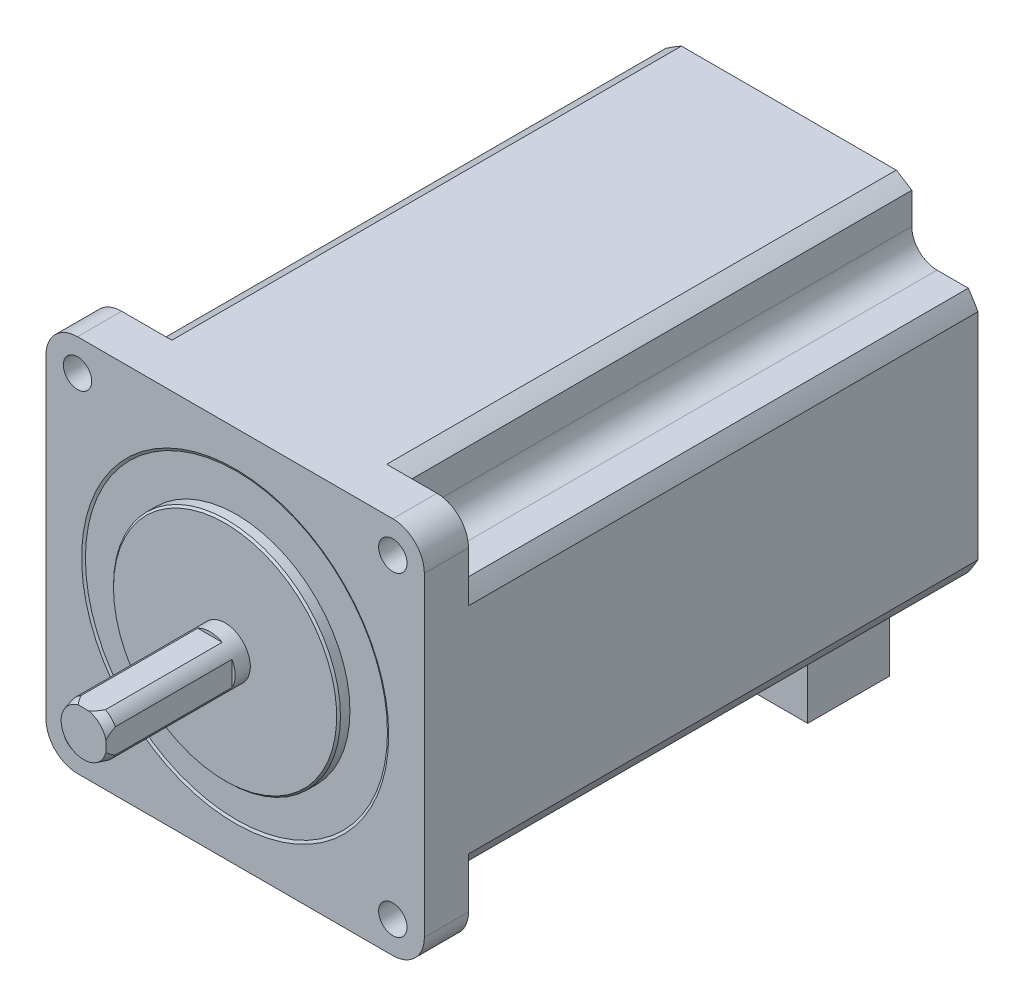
SolidWorks part; units mm, degrees
ref_plane "正面" through (0, 0, 0) normal (0, 0, 1) x (1, 0, 0)
ref_plane "平面" through (0, 0, 0) normal (0, 1, 0) x (1, 0, 0)
ref_plane "右側面" through (0, 0, 0) normal (1, 0, 0) x (0, 0, -1)
sketch "ｽｹｯﾁ1" plane through (0, 0, 0) normal (0, 0, 1) x (1, 0, 0)
  circle A0 centre (0, 0) radius 4
  dimension "D1" = 8
extrude "押し出し1" add sketch "ｽｹｯﾁ1" along normal blind 22.4
sketch "ｽｹｯﾁ2" plane through (0, 0, 0) normal (0, 0, -1) x (-1, 0, 0)
  circle A0 centre (0, 0) radius 18
  dimension "D1" = 36
extrude "押し出し2" add sketch "ｽｹｯﾁ2" along normal blind 1.6
sketch "ｽｹｯﾁ3" plane through (0, 0, -1.6) normal (0, 0, -1) x (-1, 0, 0)
  line L1 (-30, 30) -> (30, 30)
  line L2 (-30, 30) -> (-30, -30)
  line L3 (-30, -30) -> (30, -30)
  line L4 (30, 30) -> (30, -30)
  line L5 (-30, 30) -> (30, -30) construction
  line L6 (-30, -30) -> (30, 30) construction
  line L7 (25, 25) -> (-25, 25) construction
  line L8 (25, 25) -> (25, -25) construction
  line L9 (25, -25) -> (-25, -25) construction
  line L10 (-25, 25) -> (-25, -25) construction
  line L11 (25, 25) -> (-25, -25) construction
  line L12 (25, -25) -> (-25, 25) construction
  circle A0 centre (25, 25) radius 2.25
  circle A1 centre (-25, 25) radius 2.25
  circle A2 centre (25, -25) radius 2.25
  circle A3 centre (-25, -25) radius 2.25
  point P0 (0, 0)
  point P6 (0, 0)
  dimension "D3" = 50
  dimension "D4" = 50
  dimension "D6" = 4.5
  dimension "D1" = 60
  dimension "D2" = 60
extrude "押し出し3" add sketch "ｽｹｯﾁ3" along normal blind 7
fillet "Fillet1" radius 5 4 edges at (30, -30, -5.1) (-30, -30, -5.1) (-30, 30, -5.1) (30, 30, -5.1)
sketch "ｽｹｯﾁ4" plane through (0, 0, -8.6) normal (0, 0, -1) x (-1, 0, 0)
  line L0 (19.5, 19.5) -> (30, 19.5)
  line L1 (-19.5, 30) -> (19.5, 30)
  line L2 (-19.5, 30) -> (-19.5, 19.5)
  line L3 (-19.5, -30) -> (19.5, -30)
  line L4 (19.5, 30) -> (19.5, 19.5)
  line L5 (-19.5, 30) -> (19.5, -30) construction
  line L6 (-19.5, -30) -> (19.5, 30) construction
  line L7 (-30, 19.5) -> (-19.5, 19.5)
  line L8 (-30, 19.5) -> (-30, -19.5)
  line L9 (-30, -19.5) -> (-19.5, -19.5)
  line L10 (30, 19.5) -> (30, -19.5)
  line L11 (-30, 19.5) -> (30, -19.5) construction
  line L12 (-30, -19.5) -> (30, 19.5) construction
  line L13 (-19.5, -19.5) -> (-19.5, -30)
  line L14 (19.5, -19.5) -> (30, -19.5)
  line L15 (19.5, -19.5) -> (19.5, -30)
  circle A0 centre (0, 0) radius 34.5
  point P0 (0, 0)
  point P6 (0, 0)
  dimension "D5" = 69
  dimension "D1" = 39
  dimension "D2" = 60
  dimension "D3" = 60
  dimension "D4" = 39
extrude "押し出し4" add sketch "ｽｹｯﾁ4" along normal blind 80.8 contours L10 A0 L0 L4 L1 L2 L7 L8 L9 L13 L3 L15 L14
fillet "Fillet2" radius 4 4 edges at (19.5, -19.5, -49) (-19.5, -19.5, -49) (-19.5, 19.5, -49) (19.5, 19.5, -49)
sketch "Sketch1" plane through (0, -30, 0) normal (0, -1, 0) x (1, 0, 0)
  line L0 (17.0367, -89.4) -> (-17.0367, -89.4) construction
  line L1 (-16, -89.4) -> (16, -89.4)
  line L2 (-16, -89.4) -> (-16, -76.4)
  line L3 (-16, -76.4) -> (16, -76.4)
  line L4 (16, -89.4) -> (16, -76.4)
  dimension "D1" = 13
  dimension "D2" = 32
  dimension "D3" = 16
extrude "Extrude1" add sketch "Sketch1" along normal blind 10
chamfer "Chamfer1" distance 1.5 angle 15 1 edges at (4, 0, 22.4)
sketch "Sketch2" plane through (0, 0, 22.4) normal (0, 0, 1) x (1, 0, 0)
  line L1 (-4.7278, 5.1185) -> (3.4221, 5.1185)
  line L2 (-4.7278, 5.1185) -> (-4.7278, 3.5)
  line L3 (-4.7278, 3.5) -> (3.4221, 3.5)
  line L4 (3.4221, 5.1185) -> (3.4221, 3.5)
  line L5 (5.2412, 2.4413) -> (3.5, 2.4413)
  line L6 (5.2412, 2.4413) -> (5.2412, -4.2883)
  line L7 (5.2412, -4.2883) -> (3.5, -4.2883)
  line L8 (3.5, 2.4413) -> (3.5, -4.2883)
  dimension "D1" = 3.5
  dimension "D2" = 3.5
extrude "Extrude2" cut sketch "Sketch2" against normal blind 20
chamfer "Chamfer2" distance 0.3 angle 45 1 edges at (-18, 0, 0)
sketch "Sketch3" plane through (0, 0, -1.6) normal (0, 0, 1) x (1, 0, 0)
  circle A0 centre (0, 0) radius 18
  circle A1 centre (0, 0) radius 24.35
  dimension "D1" = 48.7
  dimension "D2" = 36
extrude "Extrude3" cut sketch "Sketch3" against normal blind 0.2
chamfer "Chamfer3" distance 0.2 distance2 0.4 1 edges at (24.35, 0, -1.8)
